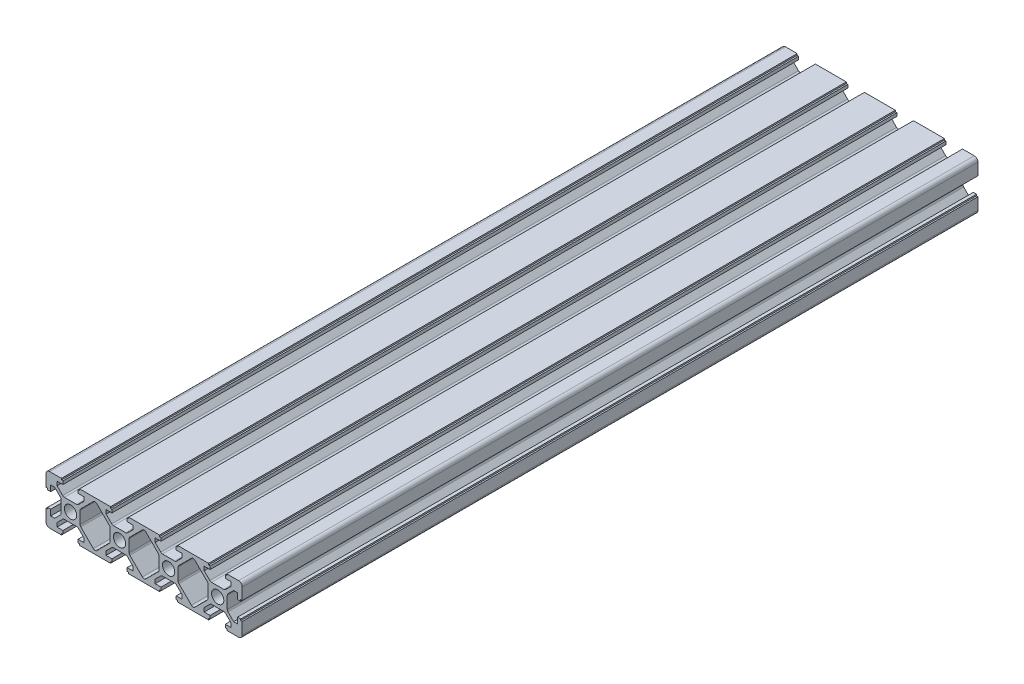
SolidWorks part; units mm, degrees
ref_plane "前视基准面" through (0, 0, 0) normal (0, 0, 1) x (1, 0, 0)
ref_plane "上视基准面" through (0, 0, 0) normal (0, 1, 0) x (1, 0, 0)
ref_plane "右视基准面" through (0, 0, 0) normal (1, 0, 0) x (0, 0, -1)
sketch "草图1"
sketch_block_instance "A$C093F2F26-1"
sketch_block "A$C093F2F26"
extrude "凸台-拉伸1" add sketch "草图1" along normal mid plane 300
